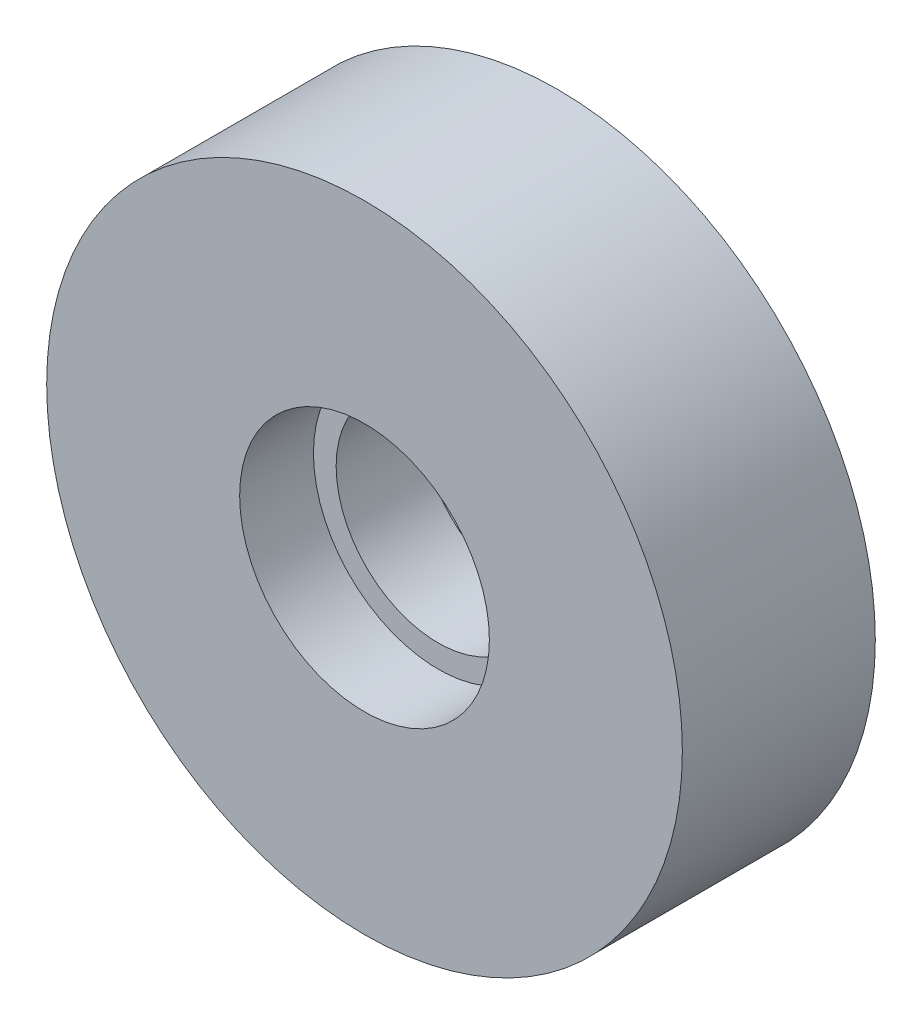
SolidWorks part; units mm, degrees
other "<Om 33>-<Boss-Extrude2>"
ref_plane "Front Plane" through (0, 0, 0) normal (0, 0, 1) x (1, 0, 0)
ref_plane "Top Plane" through (0, 0, 0) normal (0, 1, 0) x (1, 0, 0)
ref_plane "Right Plane" through (0, 0, 0) normal (1, 0, 0) x (0, 0, -1)
mirrored part "Om 33_Mirrored"
